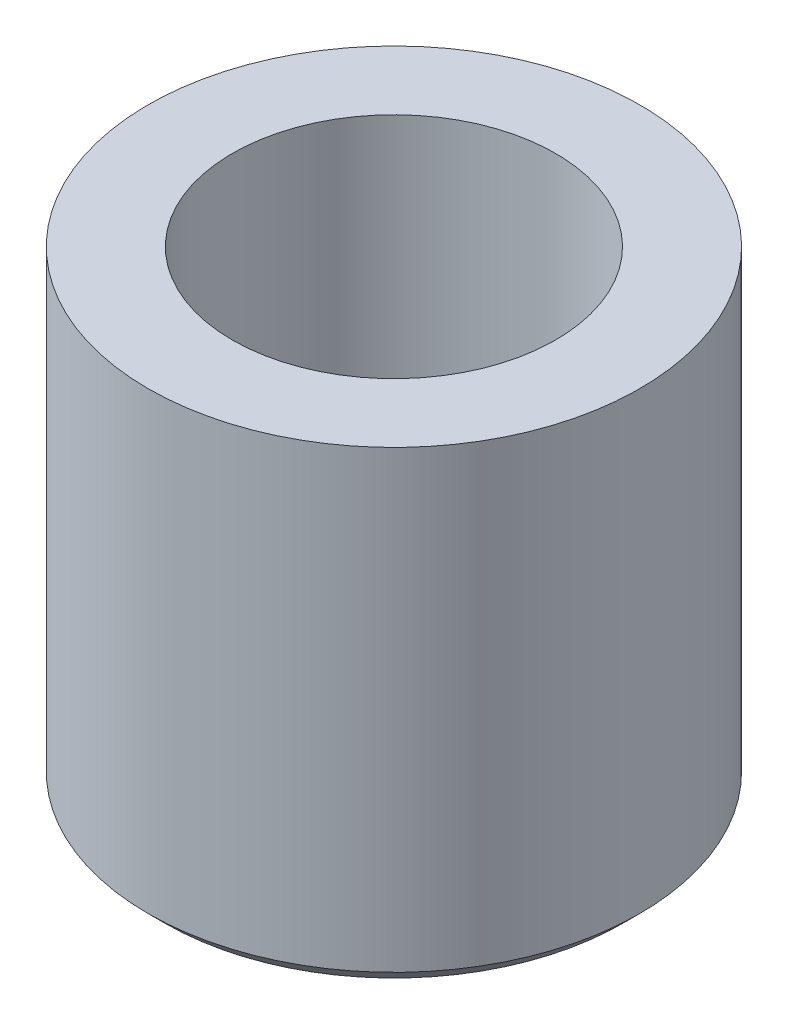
SolidWorks part; units mm, degrees
ref_plane "Front Plane" through (0, 0, 0) normal (0, 0, 1) x (1, 0, 0)
ref_plane "Top Plane" through (0, 0, 0) normal (0, 1, 0) x (1, 0, 0)
ref_plane "Right Plane" through (0, 0, 0) normal (1, 0, 0) x (0, 0, -1)
sketch "Sketch1" plane through (0, 0, 0) normal (0, 1, 0) x (1, 0, 0)
  circle A0 centre (0, 0) radius 3.65
  circle A1 centre (0, 0) radius 2.4
  dimension "D1" = 7.3
  dimension "D2" = 4.8
extrude "Boss-Extrude1" add sketch "Sketch1" along normal blind 7
chamfer "Chamfer1" distance 0.25 2 edges at (0, 0, 3.65) (0, 0, 2.4)
